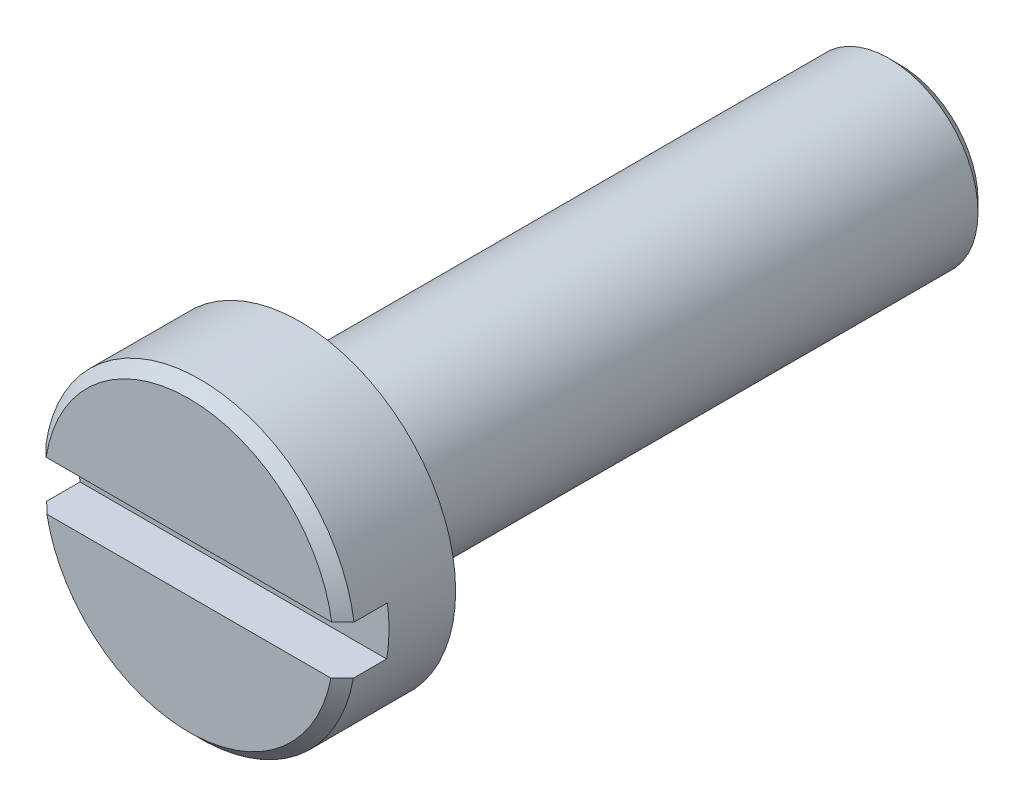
SolidWorks part; units mm, degrees
ref_plane "Front" through (0, 0, 0) normal (0, 0, 1) x (1, 0, 0)
ref_plane "Top" through (0, 0, 0) normal (0, 1, 0) x (1, 0, 0)
ref_plane "Right" through (0, 0, 0) normal (1, 0, 0) x (0, 0, -1)
sketch "Sketch1" plane through (0, 0, 0) normal (1, 0, 0) x (0, 0, -1)
  line L0 (0, 0) -> (69.4267, 0) construction
  line L1 (0, 0) -> (0, 22.225)
  line L2 (0, 22.225) -> (15.875, 22.225)
  line L3 (15.875, 22.225) -> (15.875, 12.7)
  line L4 (15.875, 12.7) -> (101.6, 12.7)
  line L5 (101.6, 12.7) -> (101.6, 0)
  line L8 (0, 0) -> (101.6, 0)
  dimension "D1" = 12.7
  dimension "D2" = 101.6
  dimension "D3" = 15.875
  dimension "D6" = 22.225
revolve "Revolve2" add sketch "Sketch1" angle 360 about L0
chamfer "Chamfer1" distance 1.5875 angle 45 2 edges at (12.7, 0, -101.6) (22.225, 0, 0)
sketch "Sketch2" plane through (0, 0, 0) normal (0, 0, 1) x (1, 0, 0)
  line L1 (-21.997, 3.175) -> (21.997, 3.175)
  line L3 (-21.896, -3.81) -> (21.896, -3.81)
  circle A0 centre (0, 0) radius 22.225 construction
  arc A1 (21.896, -3.81) -> (21.997, 3.175) centre (0, 0) ccw
  arc A2 (-21.997, 3.175) -> (-21.896, -3.81) centre (0, 0) ccw
  dimension "D1" = 6.985
  dimension "D2" = 3.175
extrude "Cut-Extrude1" cut sketch "Sketch2" against normal blind 6.35
